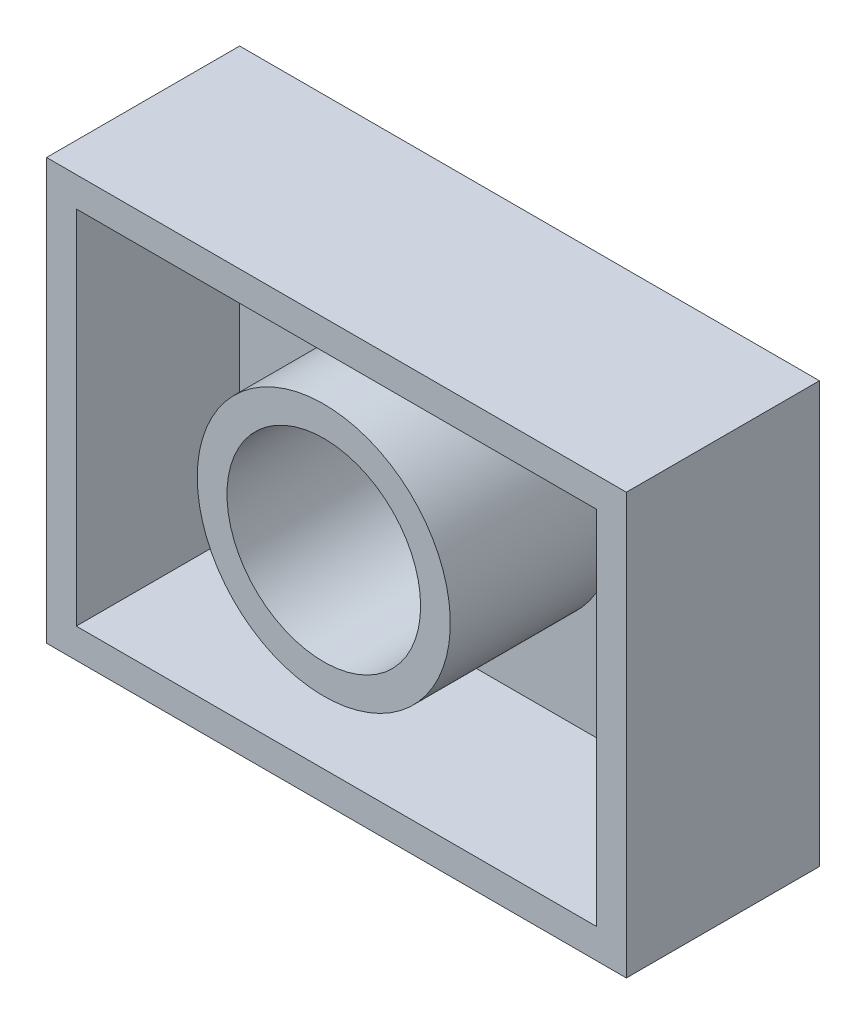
SolidWorks part; units mm, degrees
ref_plane "Front Plane" through (0, 0, 0) normal (0, 0, 1) x (1, 0, 0)
ref_plane "Top Plane" through (0, 0, 0) normal (0, 1, 0) x (1, 0, 0)
ref_plane "Right Plane" through (0, 0, 0) normal (1, 0, 0) x (0, 0, -1)
sketch "Sketch1" plane through (0, 0, 0) normal (0, 0, 1) x (1, 0, 0)
  line L1 (0, 0) -> (49.581, 0)
  line L2 (0, 0) -> (0, 35.978)
  line L3 (0, 35.978) -> (49.581, 35.978)
  line L4 (49.581, 0) -> (49.581, 35.978)
extrude "Extrude1" add sketch "Sketch1" along normal blind 16.51
sketch "Sketch2" plane through (0, 0, 16.51) normal (0, 0, 1) x (1, 0, 0)
  circle A0 centre (23.7057, 18.7511) radius 8.2802
extrude "Cut-Extrude1" cut sketch "Sketch2" against normal through all
shell "Shell1" thickness 2.54
